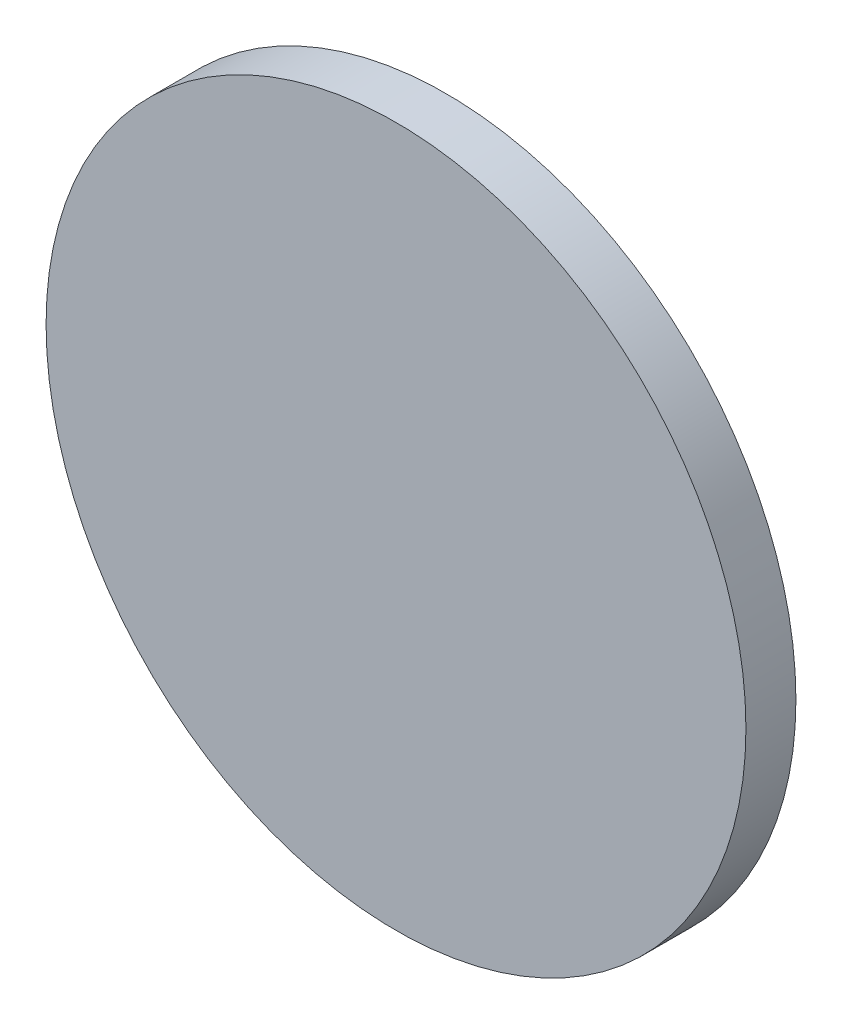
SolidWorks part; units mm, degrees
ref_plane "Front Plane" through (0, 0, 0) normal (0, 0, 1) x (1, 0, 0)
ref_plane "Top Plane" through (0, 0, 0) normal (0, 1, 0) x (1, 0, 0)
ref_plane "Right Plane" through (0, 0, 0) normal (1, 0, 0) x (0, 0, -1)
body saved out of another part "Stock-Orbbec Astra Camera-1"
